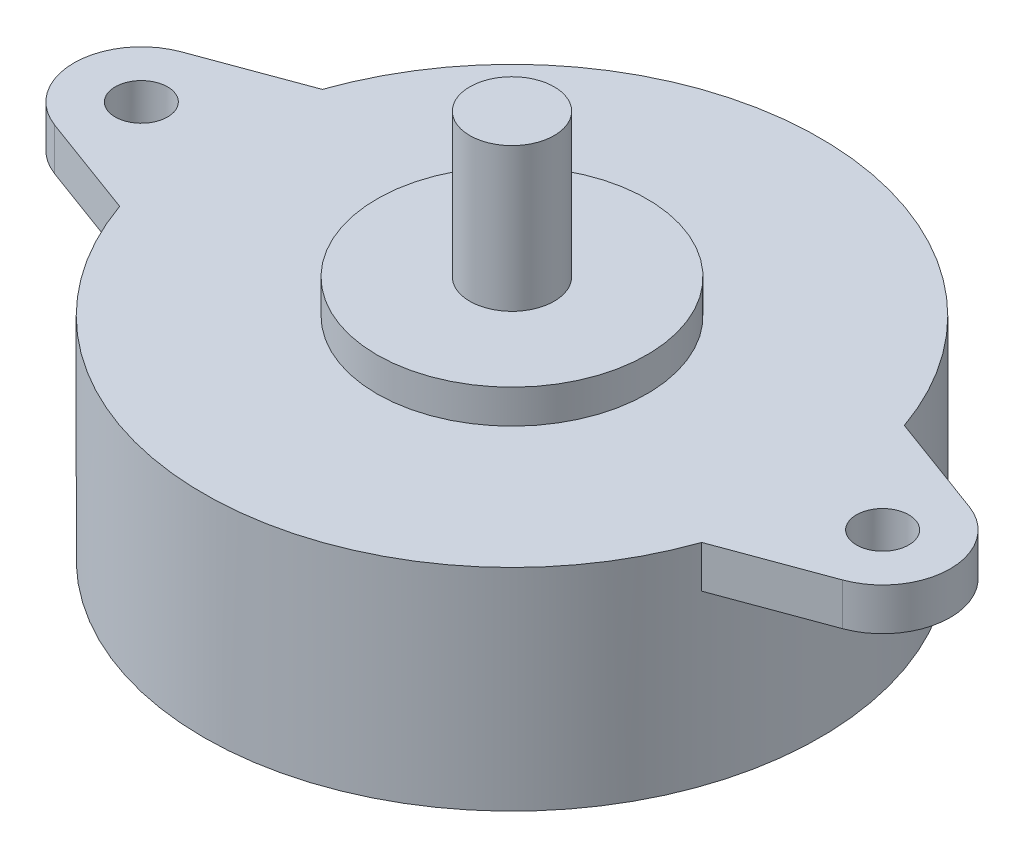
SolidWorks part; units mm, degrees
ref_plane "Piano frontale" through (0, 0, 0) normal (0, 0, 1) x (1, 0, 0)
ref_plane "Piano superiore" through (0, 0, 0) normal (0, 1, 0) x (1, 0, 0)
ref_plane "Piano destro" through (0, 0, 0) normal (1, 0, 0) x (0, 0, -1)
sketch "Schizzo1" plane through (0, 0, 0) normal (0, 1, 0) x (1, 0, 0)
  line L0 (-21.95, 0) -> (21.95, 0) construction
  line L1 (-17.2355, 6) -> (-23.333, 3.7533)
  line L3 (-23.333, -3.7533) -> (-17.2355, -6)
  line L4 (-17.2355, -6) -> (17.2355, -6) construction
  line L5 (17.2355, -6) -> (23.333, -3.7533)
  line L6 (-17.2355, -6) -> (-17.2355, 6) construction
  line L7 (23.333, 3.7533) -> (17.2355, 6)
  line L8 (-17.2355, 6) -> (17.2355, 6) construction
  line L9 (17.2355, -6) -> (17.2355, 6) construction
  line L10 (-17.2355, -6) -> (17.2355, 6) construction
  line L11 (-17.2355, 6) -> (17.2355, -6) construction
  arc A0 (17.2355, 6) -> (-17.2355, 6) centre (0, 0) ccw
  circle A1 centre (-21.95, 0) radius 1.55 construction
  arc A2 (23.333, -3.7533) -> (23.333, 3.7533) centre (21.95, 0) ccw
  circle A3 centre (21.95, 0) radius 1.55 construction
  arc A4 (-23.333, 3.7533) -> (-23.333, -3.7533) centre (-21.95, 0) ccw
  arc A5 (-17.2355, -6) -> (17.2355, -6) centre (0, 0) ccw
  point P1 (0, 0)
  dimension "D1" = 36.5
  dimension "D3" = 3.1
  dimension "D4" = 8
  dimension "D2" = 43.9
  dimension "D5" = 12
extrude "Estrusione-Estrusione1" add sketch "Schizzo1" along normal blind 12.5
sketch "Schizzo2" plane through (0, 12.5, 0) normal (0, 1, 0) x (1, 0, 0)
  circle A0 centre (0, 0) radius 8
  dimension "D1" = 16
extrude "Estrusione-Estrusione2" add sketch "Schizzo2" along normal blind 2
sketch "Schizzo3" plane through (0, 14.5, 0) normal (0, 1, 0) x (1, 0, 0)
  circle A0 centre (0, 0) radius 2.5
  dimension "D1" = 5
extrude "Estrusione-Estrusione3" add sketch "Schizzo3" along normal blind 8.5
sketch "Schizzo4" plane through (0, 0, 0) normal (0, -1, 0) x (1, 0, 0)
  circle A0 centre (0, 0) radius 27.2303
  circle A1 centre (0, 0) radius 18.25
extrude "Taglio-Estrusione1" cut sketch "Schizzo4" against normal blind 10
sketch "Schizzo5" plane through (0, 12.5, 0) normal (0, 1, 0) x (1, 0, 0)
  circle A0 centre (-21.95, 0) radius 1.55
  circle A1 centre (21.95, 0) radius 1.55
  dimension "D1" = 3.1
extrude "Taglio-Estrusione2" cut sketch "Schizzo5" against normal blind 10
